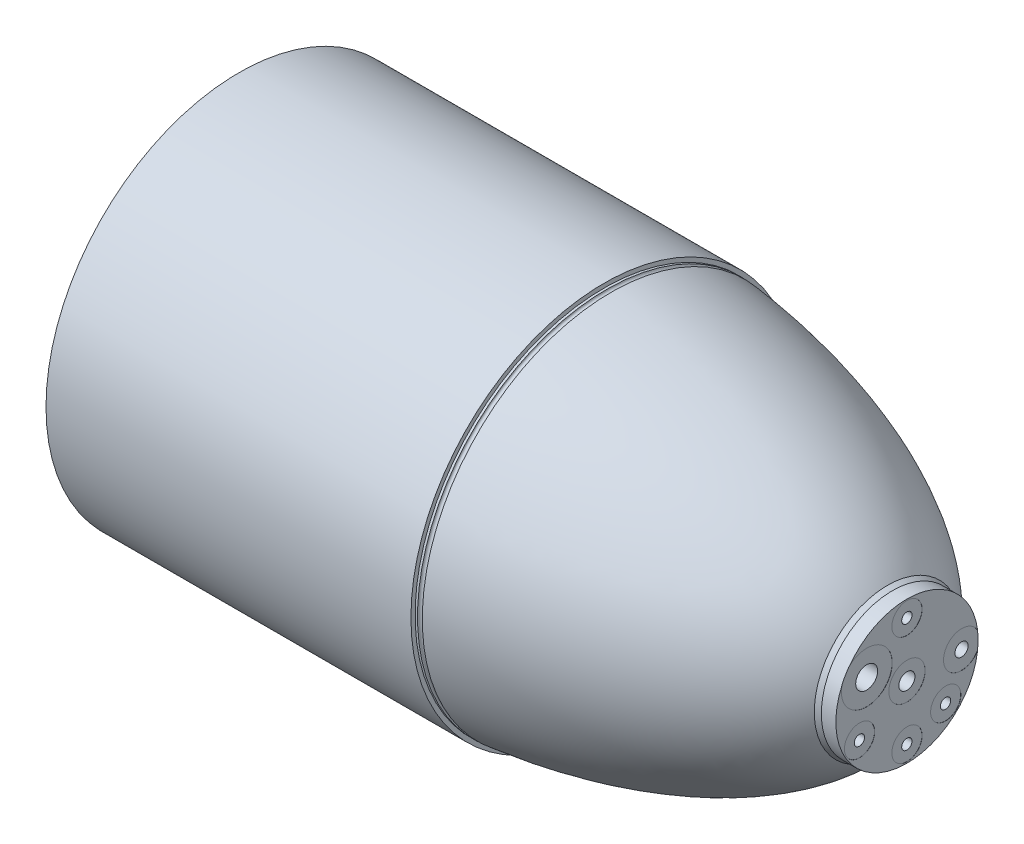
SolidWorks part; units mm, degrees
ref_plane "Plane1" through (0, 0, 0) normal (0, 0, 1) x (1, 0, 0)
ref_plane "Plane2" through (0, 0, 0) normal (0, 1, 0) x (1, 0, 0)
ref_plane "Plane3" through (0, 0, 0) normal (1, 0, 0) x (0, 0, -1)
sketch "Sketch1" plane through (0, 0, 0) normal (0, 0, 1) x (1, 0, 0)
  line L0 (355.6, 0) -> (0, 0) construction
  line L1 (326.3942, -0.0045) -> (350.52, -0.0045)
  line L2 (0, -101.346) -> (191.516, -101.346)
  line L3 (191.516, -101.346) -> (191.516, -99.147)
  line L4 (191.516, -99.147) -> (192.786, -99.147)
  line L5 (346.456, -37.3425) -> (350.52, -37.3425)
  line L6 (342.9, -37.3425) -> (346.456, -37.3425)
  line L8 (0, -101.346) -> (0, -95.5294)
  line L10 (326.3942, -42.9271) -> (326.3942, -0.0045)
  line L11 (340.36, -38.5081) -> (342.9, -37.3425)
  line L13 (350.52, -37.3425) -> (350.52, -0.0045)
  line L14 (0, -95.5294) -> (2.032, -95.5294)
  line L15 (5.334, -95.5294) -> (25.9334, -95.5294)
  line L16 (25.9334, -95.5294) -> (28.4734, -94.996)
  line L17 (28.4734, -94.996) -> (38.1254, -94.996)
  line L18 (38.1254, -94.996) -> (38.1254, -87.63)
  line L19 (38.1254, -87.63) -> (44.4754, -87.63)
  line L20 (44.4754, -87.63) -> (44.4754, -94.996)
  line L21 (44.4754, -94.996) -> (181.8894, -94.996)
  line L22 (181.8894, -94.996) -> (187.9854, -89.154)
  line L23 (187.9854, -89.154) -> (214.2936, -89.154)
  arc A0 (192.786, -99.147) -> (195.2037, -99.072) centre (193.9948, -99.1095) cw
  arc A1 (2.032, -95.5294) -> (5.334, -95.5294) centre (3.683, -95.5294) ccw
  ellipse E0 centre (152.4, 0) end of major axis (355.6, 0) minor radius 101.346 (195.2037, -99.072) -> (340.36, -38.5081) ccw
  ellipse E2 centre (152.4, 0) end of major axis (347.988, 0) minor radius 93.9839 (214.2936, -89.154) -> (326.3942, -42.9271) ccw
  dimension "D1" = 2.032
  dimension "D3" = 1.651
  dimension "D2" = 5.334
  dimension "D4" = 25.9334
  dimension "D5" = 28.4734
  dimension "D6" = 101.346
  dimension "D7" = 95.5294
  dimension "D8" = 87.63
  dimension "D9" = 38.1254
  dimension "D10" = 94.996
  dimension "D11" = 94.996
  dimension "D12" = 95.5294
  dimension "D13" = 181.8894
  dimension "D14" = 187.9854
  dimension "D15" = 89.154
  dimension "D16" = 191.516
  dimension "D17" = 326.3942
  dimension "D18" = 42.9226
  dimension "D19" = 350.52
  dimension "D20" = 37.338
  dimension "D21" = 346.456
  dimension "D23" = 38.5036
  dimension "D24" = 3.556
  dimension "D25" = 4.064
revolve "Base-Revolve" add sketch "Sketch1" angle 360 about L0
sketch "Sketch2" plane through (350.52, 0, 0) normal (1, 0, 0) x (0, 0, -1)
  circle A0 centre (-21.082, 12.192) radius 13.335
  dimension "D1" = 26.67
extrude "ANT_LAND" cut sketch "Sketch2" against normal blind 0.0762
sketch "Sketch3" plane through (350.4438, 0, 0) normal (1, 0, 0) x (0, 0, -1)
  circle A0 centre (-21.082, 12.192) radius 5.7531
  arc A2 (-34.0328, 15.3697) -> (-30.2955, 21.8322) centre (-21.082, 12.192) ccw construction
  dimension "D1" = 11.5062
extrude "ant_thru" cut sketch "Sketch3" against normal blind 25.4
sketch "Sketch4" plane through (350.52, 0, 0) normal (1, 0, 0) x (0, 0, -1)
  circle A0 centre (0, 0) radius 4.2164
  dimension "D1" = 8.4328
extrude "HYD_THRU" cut sketch "Sketch4" against normal blind 50.8
sketch "Sketch5" plane through (350.52, 0, 0) normal (1, 0, 0) x (0, 0, -1)
  circle A0 centre (0, 0) radius 9.525
  dimension "D1" = 19.05
extrude "HYD_LAND" cut sketch "Sketch5" against normal blind 0.0508
sketch "Sketch6" plane through (350.52, 0, 0) normal (1, 0, 0) x (0, 0, -1)
  circle A0 centre (0, 28.702) radius 7.9375
  dimension "D1" = 15.875
extrude "B_LAND" cut sketch "Sketch6" against normal blind 0.0762
sketch "Sketch7" plane through (350.4438, 0, 0) normal (1, 0, 0) x (0, 0, -1)
  circle A0 centre (0, 28.702) radius 2.7051
  circle A1 centre (0, 28.702) radius 7.9375 construction
extrude "B_THRU" cut sketch "Sketch7" against normal blind 50.8
sketch "Sketch8" plane through (350.52, 0, 0) normal (1, 0, 0) x (0, 0, -1)
  circle A0 centre (28.702, 0) radius 9.525
  dimension "D1" = 19.05
extrude "PRESS_LAND" cut sketch "Sketch8" against normal blind 0.0762
sketch "Sketch9" plane through (350.4438, 0, 0) normal (1, 0, 0) x (0, 0, -1)
  circle A0 centre (28.702, 0) radius 3.4544
  arc A2 (37.0626, 4.5635) -> (37.0626, -4.5635) centre (28.702, 0) ccw construction
  dimension "D1" = 6.9088
extrude "PRESS_THRU" cut sketch "Sketch9" against normal blind 50.8
sketch "Sketch10" plane through (350.52, 0, 0) normal (1, 0, 0) x (0, 0, -1)
  circle A0 centre (20.32, -20.32) radius 7.9375
  dimension "D1" = 15.875
extrude "C_LAND" cut sketch "Sketch10" against normal blind 0.0762
sketch "Sketch11" plane through (350.4438, 0, 0) normal (1, 0, 0) x (0, 0, -1)
  circle A0 centre (20.32, -20.32) radius 2.7051
  circle A2 centre (20.32, -20.32) radius 7.9375 construction
  dimension "D1" = 5.4102
extrude "C_THRU" cut sketch "Sketch11" against normal blind 50.8
sketch "Sketch12" plane through (350.52, 0, 0) normal (1, 0, 0) x (0, 0, -1)
  circle A0 centre (0, -28.702) radius 7.9375
  dimension "D1" = 15.875
extrude "D_LAND" cut sketch "Sketch12" against normal blind 0.0762
sketch "Sketch13" plane through (350.4438, 0, 0) normal (1, 0, 0) x (0, 0, -1)
  circle A0 centre (0, -28.702) radius 2.7051
  circle A2 centre (0, -28.702) radius 7.9375 construction
  dimension "D1" = 5.4102
extrude "D_THRU" cut sketch "Sketch13" against normal blind 50.8
sketch "Sketch14" plane through (350.52, 0, 0) normal (1, 0, 0) x (0, 0, -1)
  circle A0 centre (-24.892, -14.478) radius 7.9375
  dimension "D1" = 15.875
extrude "E_LAND" cut sketch "Sketch14" against normal blind 0.0762
sketch "Sketch15" plane through (350.4438, 0, 0) normal (1, 0, 0) x (0, 0, -1)
  circle A0 centre (-24.892, -14.478) radius 2.7051
  circle A2 centre (-24.892, -14.478) radius 7.9375 construction
  dimension "D1" = 5.4102
extrude "E_THRU" cut sketch "Sketch15" against normal blind 50.8
sketch "Sketch19" plane through (38.1254, 0, 0) normal (-1, 0, 0) x (0, 0, 1)
  circle A0 centre (0, 91.44) radius 2.159
  circle A1 centre (64.6578, 64.6578) radius 2.159
  circle A2 centre (91.44, 0) radius 2.159
  circle A3 centre (64.6578, -64.6578) radius 2.159
  circle A4 centre (0, -91.44) radius 2.159
  circle A5 centre (-64.6578, -64.6578) radius 2.159
  circle A6 centre (-91.44, 0) radius 2.159
  circle A7 centre (-64.6578, 64.6578) radius 2.159
  dimension "D2" = 4.318
  dimension "D1" = 91.44
extrude "interior_bc" cut sketch "Sketch19" against normal up to next
